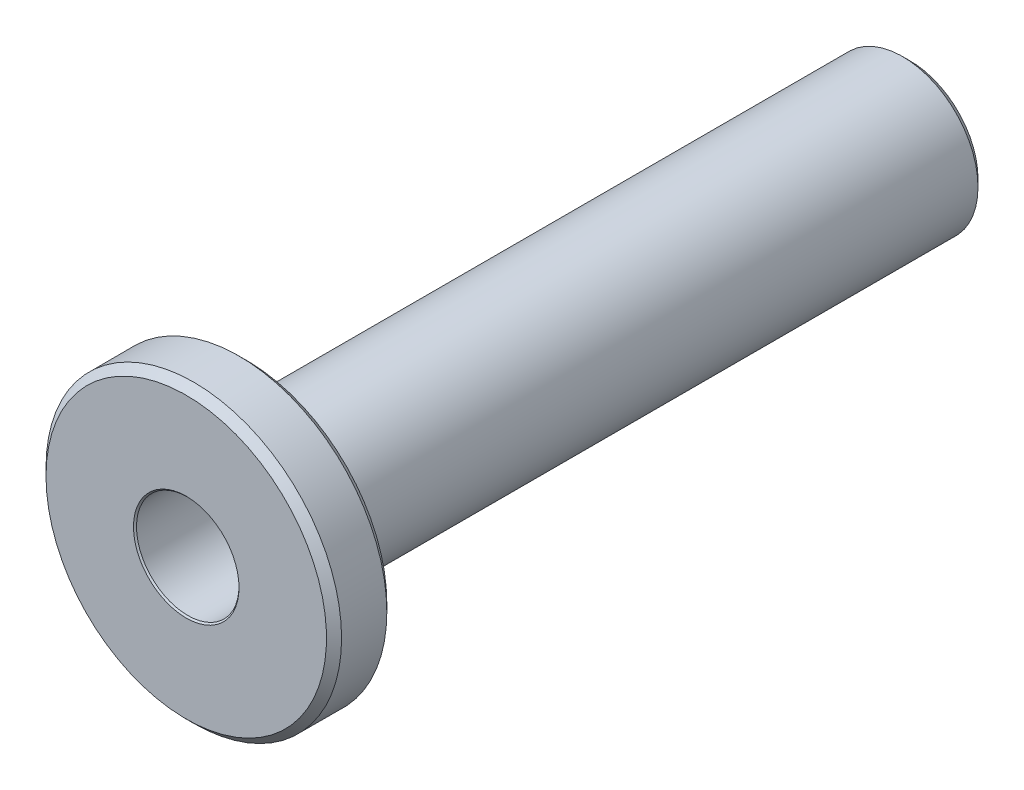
SolidWorks part; units mm, degrees
other "Thread1[1]"
ref_plane "Front Plane" through (0, 0, 0) normal (0, 0, 1) x (1, 0, 0)
ref_plane "Top Plane" through (0, 0, 0) normal (0, 1, 0) x (1, 0, 0)
ref_plane "Right Plane" through (0, 0, 0) normal (1, 0, 0) x (0, 0, -1)
imported_body "Imported1"
sketch "Sketch1" plane through (0, 0, -18) normal (0, 0, -1) x (-1, 0, 0)
  circle A0 centre (0, 0) radius 1.7
  dimension "D1" = 3.4
extrude "Cut-Extrude1" cut sketch "Sketch1" against normal through all both and the other way through all
other "Move Face1" parameters "D1"=6
